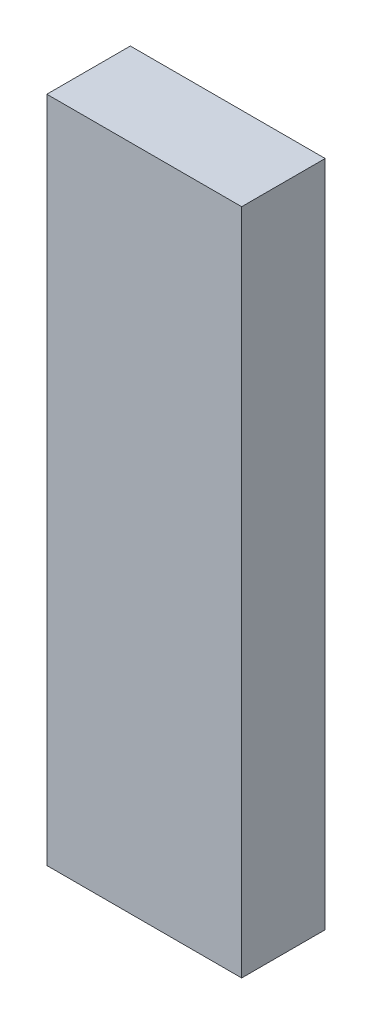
SolidWorks part; units mm, degrees
ref_plane "Front Plane" through (0, 0, 0) normal (0, 0, 1) x (1, 0, 0)
ref_plane "Top Plane" through (0, 0, 0) normal (0, 1, 0) x (1, 0, 0)
ref_plane "Right Plane" through (0, 0, 0) normal (1, 0, 0) x (0, 0, -1)
sketch "Sketch1" plane through (0, 0, 0) normal (0, 1, 0) x (1, 0, 0)
  line L1 (0, 0) -> (88.9, 0)
  line L2 (0, 0) -> (0, 38.1)
  line L3 (0, 38.1) -> (88.9, 38.1)
  line L4 (88.9, 0) -> (88.9, 38.1)
  dimension "D1" = 38.1
  dimension "D2" = 88.9
extrude "Boss-Extrude1" add sketch "Sketch1" along normal blind 304.8
